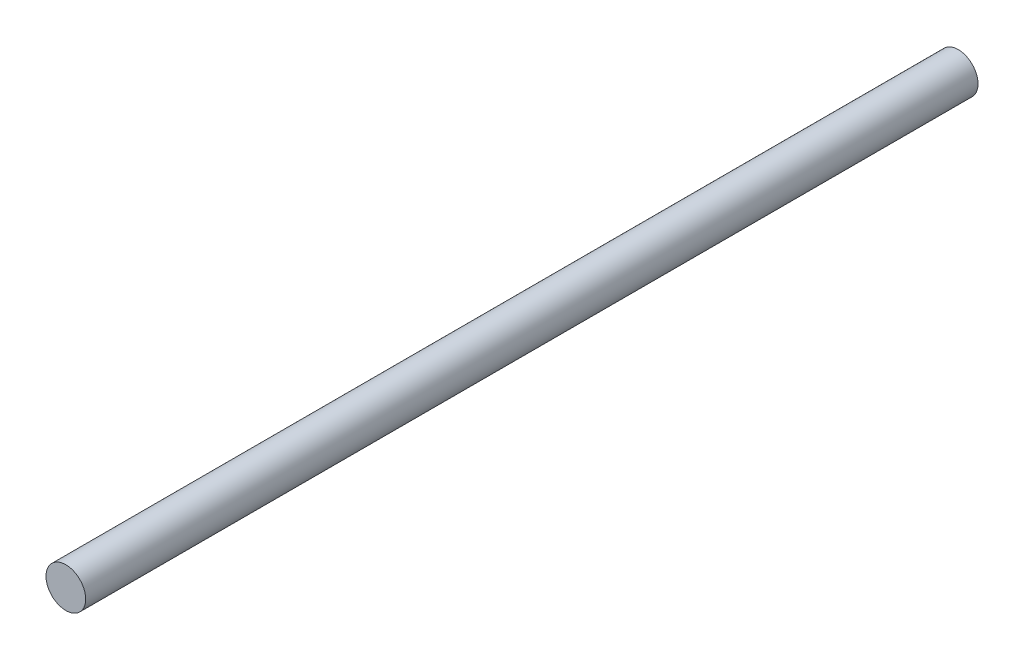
SolidWorks part; units mm, degrees
ref_plane "Front Plane" through (0, 0, 0) normal (0, 0, 1) x (1, 0, 0)
ref_plane "Top Plane" through (0, 0, 0) normal (0, 1, 0) x (1, 0, 0)
ref_plane "Right Plane" through (0, 0, 0) normal (1, 0, 0) x (0, 0, -1)
sketch "Sketch1" plane through (0, 0, 0) normal (0, 0, 1) x (1, 0, 0)
  circle A0 centre (0, 0) radius 1
  dimension "D1" = 2
extrude "Boss-Extrude1" add sketch "Sketch1" along normal mid plane 45
